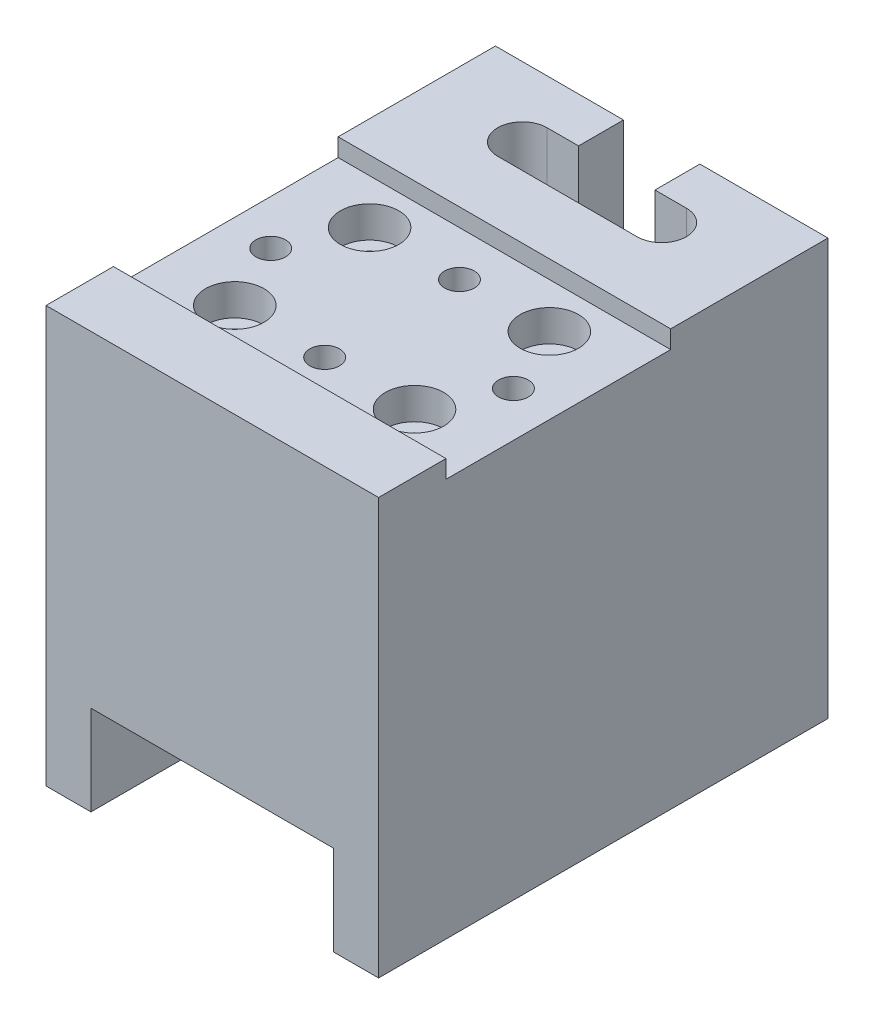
SolidWorks part; units mm, degrees
ref_plane "前视基准面" through (0, 0, 0) normal (0, 0, 1) x (1, 0, 0)
ref_plane "上视基准面" through (0, 0, 0) normal (0, 1, 0) x (1, 0, 0)
ref_plane "右视基准面" through (0, 0, 0) normal (1, 0, 0) x (0, 0, -1)
sketch "草图1" plane through (0, 0, 0) normal (0, 0, 1) x (1, 0, 0)
  line L0 (5, 10) -> (32, 10)
  line L1 (0, 46.3) -> (37, 46.3)
  line L2 (5, 0) -> (5, 10)
  line L3 (32, 0) -> (32, 10)
  line L4 (37, 0) -> (37, 46.3)
  line L5 (0, 0) -> (0, 46.3)
  line L6 (0, 0) -> (5, 0)
  line L7 (32, 0) -> (37, 0)
extrude "凸台-拉伸1" add sketch "草图1" along normal blind 50
sketch "草图2" plane through (37, 0, 0) normal (1, 0, 0) x (0, 0, -1)
  line L0 (-42.5, 46.3) -> (-42.5, 44.3)
  line L1 (-17.5, 46.3) -> (-17.5, 44.3)
  line L2 (-42.5, 44.3) -> (-17.5, 44.3)
extrude "切除-拉伸1" cut sketch "草图2" against normal through all and the other way through all flip side to cut
sketch "草图3" plane through (0, 46.3, 0) normal (0, 1, 0) x (1, 0, 0)
  line L0 (0, -50) -> (37, -50)
  line L1 (0, 0) -> (14.25, 0)
  line L2 (37, -50) -> (37, 0)
  line L3 (0, -50) -> (0, 0)
  line L4 (10.75, -5) -> (14.25, -5)
  line L5 (10.75, -10.5) -> (26.25, -10.5)
  line L6 (14.25, -5) -> (14.25, 0)
  line L7 (22.75, -5) -> (22.75, 0)
  line L8 (22.75, -5) -> (26.25, -5)
  line L9 (22.75, 0) -> (37, 0)
  circle A0 centre (8.5, -37.5) radius 1.75
  circle A1 centre (28.5, -37.5) radius 1.75
  circle A2 centre (28.5, -22.5) radius 1.75
  circle A3 centre (8.5, -22.5) radius 1.75
  arc A4 (26.25, -10.5) -> (26.25, -5) centre (26.25, -7.75) ccw
  arc A5 (10.75, -5) -> (10.75, -10.5) centre (10.75, -7.75) ccw
extrude "切除-拉伸2" cut sketch "草图3" against normal blind 50 flip side to cut
sketch "草图4" plane through (0, 44.3, 0) normal (0, 1, 0) x (1, 0, 0)
  circle A0 centre (8.5, -37.5) radius 3.25
  circle A1 centre (28.5, -37.5) radius 3.25
  circle A2 centre (28.5, -22.5) radius 3.25
  circle A3 centre (8.5, -22.5) radius 3.25
extrude "切除-拉伸3" cut sketch "草图4" against normal blind 3.5
sketch "草图5" plane through (0, 44.3, 0) normal (0, 1, 0) x (1, 0, 0)
  circle A0 centre (18.5, -22.5) radius 1.65
  circle A1 centre (32, -30) radius 1.65
  circle A2 centre (18.5, -37.5) radius 1.65
  circle A3 centre (5, -30) radius 1.65
extrude "切除-拉伸4" cut sketch "草图5" against normal blind 15
